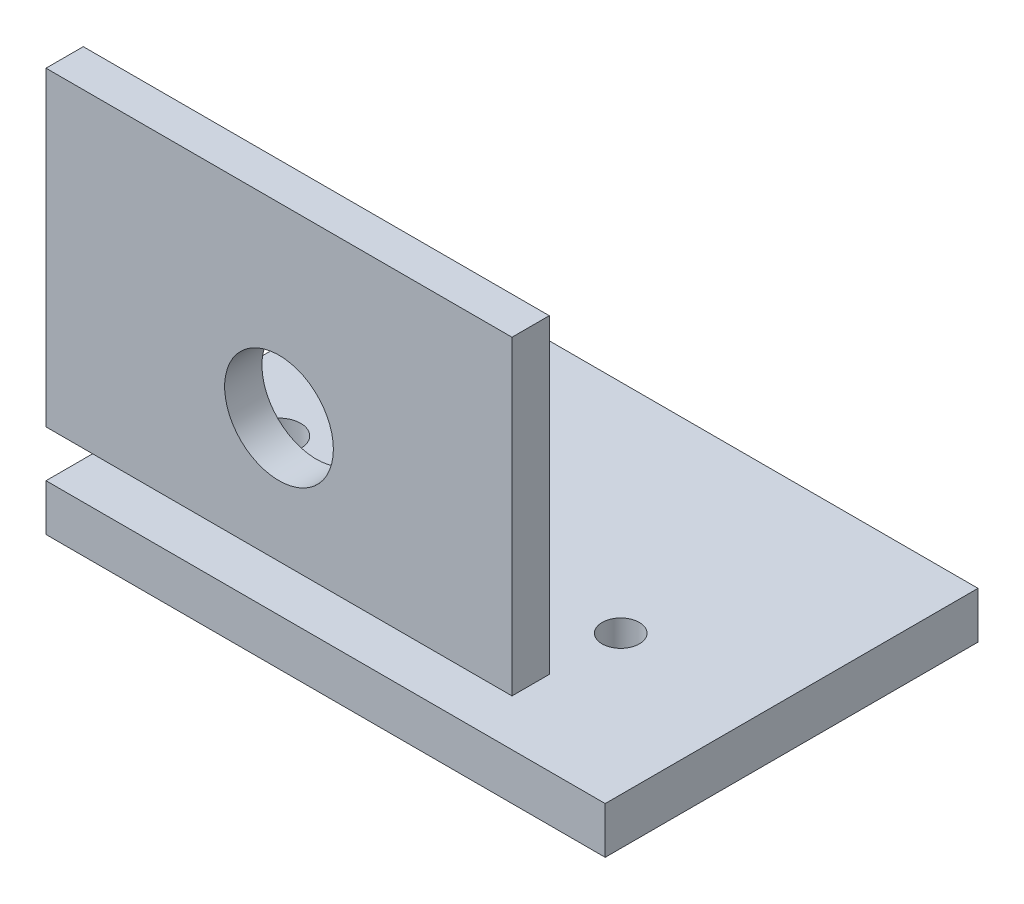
SolidWorks part; units mm, degrees
ref_plane "前视基准面" through (0, 0, 0) normal (0, 0, 1) x (1, 0, 0)
ref_plane "上视基准面" through (0, 0, 0) normal (0, 1, 0) x (1, 0, 0)
ref_plane "右视基准面" through (0, 0, 0) normal (1, 0, 0) x (0, 0, -1)
other "Configuration Table"
sketch "草图1" plane through (0, 0, 0) normal (0, 1, 0) x (1, 0, 0)
  line L1 (0, 0) -> (180, 0)
  line L2 (0, 0) -> (0, 120)
  line L3 (0, 120) -> (180, 120)
  line L4 (180, 0) -> (180, 120)
  dimension "D1" = 180
  dimension "D2" = 120
extrude "凸台-拉伸1" add sketch "草图1" against normal blind 15
sketch "草图2" plane through (0, 0, 0) normal (0, 1, 0) x (1, 0, 0)
  line L0 (25, 50) -> (135, 50) construction
  circle A0 centre (25, 50) radius 7
  circle A1 centre (135, 50) radius 6
  dimension "D2" = 14
  dimension "D1" = 110
extrude "切除-拉伸1" cut sketch "草图2" against normal blind 15
sketch "草图3" plane through (0, 0, 0) normal (0, 0, 1) x (1, 0, 0)
  line L1 (0, 15) -> (150, 15)
  line L2 (0, 15) -> (0, 115)
  line L3 (0, 115) -> (150, 115)
  line L4 (150, 15) -> (150, 115)
  dimension "D1" = 100
extrude "凸台-拉伸2" add sketch "草图3" against normal blind 12
sketch "草图4" plane through (0, 0, 0) normal (0, 0, 1) x (1, 0, 0)
  circle A0 centre (75, 55) radius 17.5
  dimension "D1" = 35
extrude "切除-拉伸2" cut sketch "草图4" against normal blind 12
